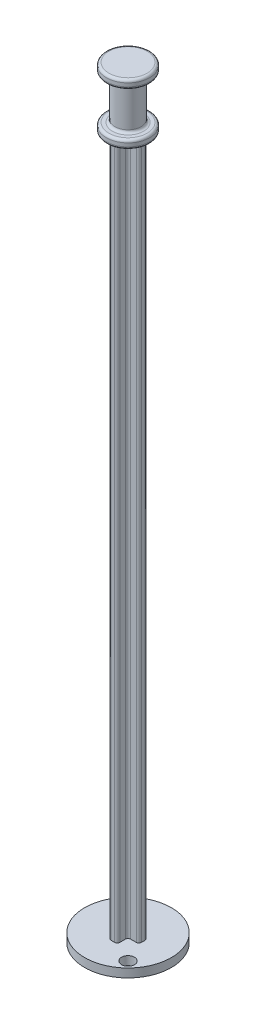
SolidWorks part; units mm, degrees
ref_plane "Ebene vorne" through (0, 0, 0) normal (0, 0, 1) x (1, 0, 0)
ref_plane "Ebene oben" through (0, 0, 0) normal (0, 1, 0) x (1, 0, 0)
ref_plane "Ebene rechts" through (0, 0, 0) normal (1, 0, 0) x (0, 0, -1)
sketch "Skizze1" plane through (0, 0, 0) normal (0, 0, 1) x (1, 0, 0)
  line L0 (0, 0) -> (2.2, 0)
  line L1 (2.5, 0.3) -> (2.5, 0.7)
  line L2 (2.2, 1) -> (1.8, 1)
  line L3 (1.5, 1.3) -> (1.5, 5.7)
  line L4 (1.8, 6) -> (2.2, 6)
  line L5 (2.5, 6.3) -> (2.5, 6.7)
  line L6 (2.2, 7) -> (0, 7)
  line L7 (0, 0) -> (0, 91.6322) construction
  line L8 (0, 0) -> (0, 7)
  arc A0 (1.5, 5.7) -> (1.8, 6) centre (1.8, 5.7) cw
  arc A1 (1.8, 1) -> (1.5, 1.3) centre (1.8, 1.3) cw
  arc A2 (2.2, 0) -> (2.5, 0.3) centre (2.2, 0.3) ccw
  arc A3 (2.5, 0.7) -> (2.2, 1) centre (2.2, 0.7) ccw
  arc A4 (2.2, 6) -> (2.5, 6.3) centre (2.2, 6.3) ccw
  arc A5 (2.5, 6.7) -> (2.2, 7) centre (2.2, 6.7) ccw
  point P12 (1.5, 6)
  point P15 (1.5, 1)
  point P18 (2.5, 0)
  point P21 (2.5, 1)
  point P24 (2.5, 6)
  point P27 (2.5, 7)
  dimension "D7" = 0.3
  dimension "D1" = 5
  dimension "D2" = 1
  dimension "D3" = 1
  dimension "D4" = 5
  dimension "D5" = 5
  dimension "D6" = 3
revolve "Rotation1" add sketch "Skizze1" angle 360 about L7
sketch "Skizze2" plane through (0, 0, 0) normal (0, -1, 0) x (-1, 0, 0)
  line L0 (3.1328, 0) -> (-3.2025, 0) construction
  line L1 (0, -2.7537) -> (0, 3.0497) construction
  line L2 (0.5, -1.45) -> (0.5, -0.8)
  line L3 (0.8, -0.5) -> (1.45, -0.5)
  line L4 (1.75, -0.2) -> (1.75, 0.2)
  line L5 (1.45, 0.5) -> (0.8, 0.5)
  line L6 (0.5, 0.8) -> (0.5, 1.45)
  line L7 (0.2, 1.75) -> (-0.2, 1.75)
  line L8 (-0.5, 1.45) -> (-0.5, 0.8)
  line L9 (-0.8, 0.5) -> (-1.45, 0.5)
  line L10 (-1.75, 0.2) -> (-1.75, -0.2)
  line L11 (-1.45, -0.5) -> (-0.8, -0.5)
  line L12 (-0.5, -0.8) -> (-0.5, -1.45)
  line L13 (-0.2, -1.75) -> (0.2, -1.75)
  arc A0 (-0.8, -0.5) -> (-0.5, -0.8) centre (-0.8, -0.8) cw
  arc A1 (-1.75, -0.2) -> (-1.45, -0.5) centre (-1.45, -0.2) ccw
  arc A2 (-1.45, 0.5) -> (-1.75, 0.2) centre (-1.45, 0.2) ccw
  arc A3 (-0.5, 0.8) -> (-0.8, 0.5) centre (-0.8, 0.8) cw
  arc A4 (-0.2, 1.75) -> (-0.5, 1.45) centre (-0.2, 1.45) ccw
  arc A5 (0.5, 1.45) -> (0.2, 1.75) centre (0.2, 1.45) ccw
  arc A6 (0.8, 0.5) -> (0.5, 0.8) centre (0.8, 0.8) cw
  arc A7 (1.75, 0.2) -> (1.45, 0.5) centre (1.45, 0.2) ccw
  arc A8 (1.45, -0.5) -> (1.75, -0.2) centre (1.45, -0.2) ccw
  arc A9 (0.5, -0.8) -> (0.8, -0.5) centre (0.8, -0.8) cw
  arc A10 (0.5, -1.45) -> (0.2, -1.75) centre (0.2, -1.45) cw
  arc A11 (-0.5, -1.45) -> (-0.2, -1.75) centre (-0.2, -1.45) ccw
  point P22 (-1.75, -0.5)
  point P25 (-1.75, 0.5)
  point P30 (-0.5, 1.75)
  point P33 (0.5, 1.75)
  point P38 (1.75, 0.5)
  point P41 (1.75, -0.5)
  point P44 (0.5, -0.5)
  point P47 (0.5, -1.75)
  point P50 (-0.5, -1.75)
  dimension "D11" = 0.3
  dimension "D1" = 1.75
  dimension "D2" = 1.75
  dimension "D3" = 0.5
  dimension "D4" = 1
  dimension "D5" = 1
  dimension "D6" = 1
  dimension "D7" = 1
  dimension "D8" = 0.5
  dimension "D9" = 0.5
  dimension "D10" = 1.75
  dimension "D12" = 1.75
extrude "Aufsatz-Linear austragen1" add sketch "Skizze2" along normal blind 80 separate body
sketch "Skizze3" plane through (0, -80, 0) normal (0, -1, 0) x (-1, 0, 0)
  circle A0 centre (0, 0) radius 5
  dimension "D1" = 10
extrude "Aufsatz-Linear austragen2" add sketch "Skizze3" along normal blind 1 separate body
sketch "Skizze4" plane through (0, -81, 0) normal (0, -1, 0) x (1, 0, 0)
  line L0 (0, 0) -> (2.8284, 2.8284) construction
  line L1 (0, 0) -> (0, 3.3373) construction
  circle A0 centre (2.8284, 2.8284) radius 0.75
  dimension "D1" = 1.5
  dimension "D2" = 45
  dimension "D3" = 4
extrude "Schnitt-Linear austragen1" cut sketch "Skizze4" against normal blind 3
